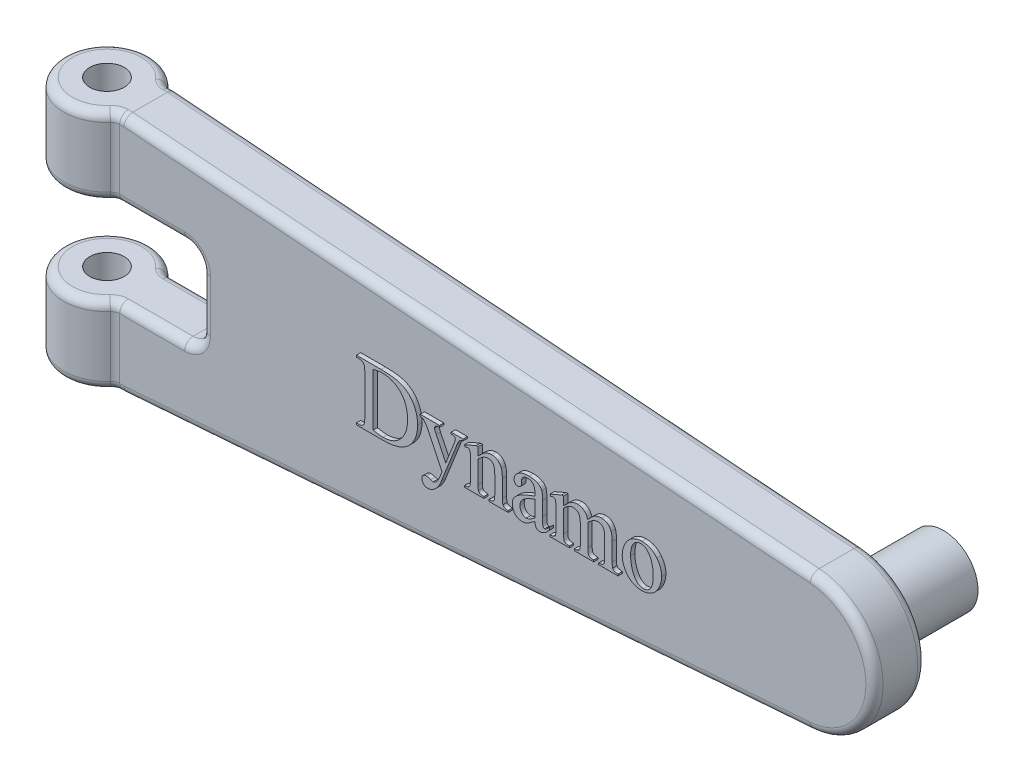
SolidWorks part; units mm, degrees
ref_plane "Face" through (0, 0, 0) normal (0, 0, 1) x (1, 0, 0)
ref_plane "Dessus" through (0, 0, 0) normal (0, 1, 0) x (1, 0, 0)
ref_plane "Droite" through (0, 0, 0) normal (1, 0, 0) x (0, 0, -1)
sketch "Esquisse1" plane through (0, 0, 0) normal (0, 0, 1) x (1, 0, 0)
  line L0 (0, 0) -> (61.0569, 0) construction
  line L1 (0, 21.0476) -> (0, -19.9099) construction
  line L2 (0, 7) -> (2.5, 7)
  line L3 (2.5, 7) -> (42.3018, 3.9886)
  line L4 (0, 2.5) -> (6, 2.5)
  line L5 (7, 1.5) -> (7, -1.5)
  line L6 (0, 2.5) -> (0, 7)
  line L7 (0, -2.5) -> (0, -7)
  line L8 (0, -2.5) -> (6, -2.5)
  line L9 (2.5, -7) -> (42.3018, -3.9886)
  line L10 (0, -7) -> (2.5, -7)
  arc A0 (42.3018, -3.9886) -> (42.3018, 3.9886) centre (42, 0) ccw
  arc A1 (6, 2.5) -> (7, 1.5) centre (6, 1.5) cw
  arc A2 (6, -2.5) -> (7, -1.5) centre (6, -1.5) ccw
  point P15 (7, 2.5)
  point P21 (7, 0)
  point P22 (7, -2.5)
  dimension "D2" = 8
  dimension "D7" = 1
  dimension "D1" = 42
  dimension "D3" = 7
  dimension "D4" = 7
  dimension "D5" = 2.5
  dimension "D6" = 2.5
extrude "Boss.-Extru.1" add sketch "Esquisse1" along normal blind 3
sketch "Esquisse2" plane through (0, 7, 0) normal (0, 1, 0) x (1, 0, 0)
  line L0 (0, -3) -> (0, 0) construction
  circle A0 centre (0, -1.5) radius 2.5
extrude "Boss.-Extru.2" add sketch "Esquisse2" against normal blind 4.5
mirror "Symétrie1" about plane through (0, 0, 0) normal (0, 1, 0) of "Boss.-Extru.2"
sketch "Esquisse3" plane through (0, 7, 0) normal (0, 1, 0) x (1, 0, 0)
  circle A0 centre (0, -1.5) radius 1
  dimension "D1" = 2
extrude "Enlèv. mat.-Extru.1" cut sketch "Esquisse3" against normal through all
fillet "Congé1" radius 0.5 28 edges at (-2.5, -7, 1.5) (-2.5, 2.5, 1.5) (-2.5, 7, 1.5) (-2.5, -2.5, 1.5) (6.7071, -2.2071, 3) (7, 0, 3) (6.7071, 2.2071, 3) (4, 2.5, 3) (2, 4.75, 3) (2.25, 7, 3) (22.4009, 5.4943, 3) (46, 0, 3) (22.4009, -5.4943, 3) (2.25, -7, 3) (2, -4.75, 3) (4, -2.5, 3) (2.25, -7, 0) (22.4009, -5.4943, 0) (46, 0, 0) (22.4009, 5.4943, 0) (2.25, 7, 0) (2, 4.75, 0) (4, 2.5, 0) (6.7071, 2.2071, 0) (7, 0, 0) (6.7071, -2.2071, 0) (4, -2.5, 0) (2, -4.75, 0)
sketch "Esquisse4" plane through (0, 0, 3) normal (0, 0, 1) x (1, 0, 0)
  text T0 "Dynamo" font "Times New Roman" height 3.5
extrude "Boss.-Extru.3" add sketch "Esquisse4" along normal blind 0.25
sketch "Esquisse5" plane through (0, 0, 0) normal (0, 0, -1) x (-1, 0, 0)
  circle A0 centre (-42, 0) radius 2
  dimension "D1" = 4
extrude "Boss.-Extru.4" add sketch "Esquisse5" along normal blind 5
hole_wizard "Trou taraudé M21" positions "Esquisse3D1" profile "Esquisse6" tap size "M2" standard "ISO"
sketch3d "Esquisse3D1"
  line L0 (42, 0, -5) -> (42, 0, 0) construction
  point P0 (42, 0, -5)
sketch "Esquisse6" plane through (42, 0, -5) normal (1, 0, 0) x (0, 1, 0)
  line L0 (0, 0) -> (0, 6.4807)
  line L1 (0, 6.4807) -> (0.8, 6)
  line L2 (0.8, 6) -> (0.8, 0)
  line L5 (0.8, 0) -> (0, 0)
  line L10 (0, 6.4807) -> (-0.8, 6) construction
  line L11 (0, -6.35) -> (0, 107.95) construction
  dimension "Diamètre du trou pour taraudage" = 1.6
  dimension "Profondeur du trou pour taraudage" = 6
  dimension "Angle de pointe" = 118
